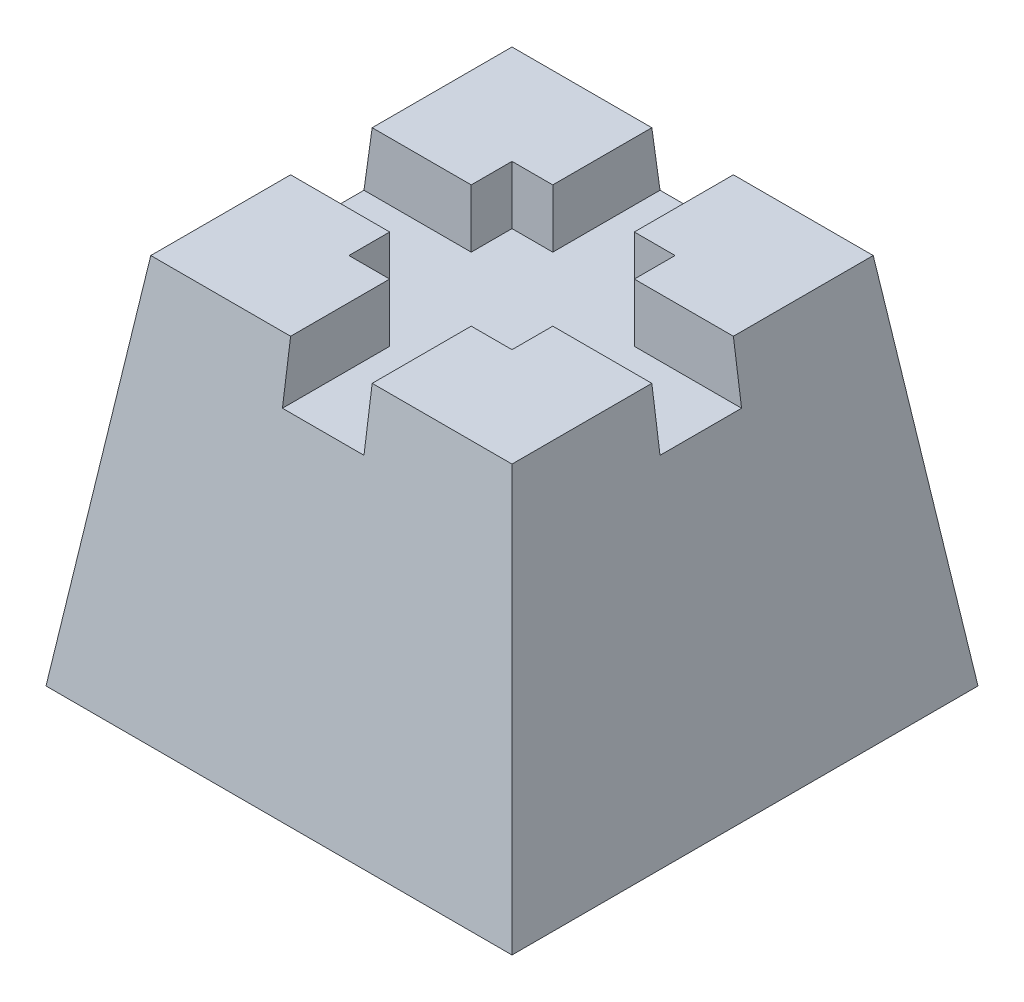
SolidWorks part; units mm, degrees
ref_plane "Front Plane" through (0, 0, 0) normal (0, 0, 1) x (1, 0, 0)
ref_plane "Top Plane" through (0, 0, 0) normal (0, 1, 0) x (1, 0, 0)
ref_plane "Right Plane" through (0, 0, 0) normal (1, 0, 0) x (0, 0, -1)
sketch "Sketch1" plane through (0, 0, 0) normal (0, 1, 0) x (1, 0, 0)
  line L0 (127, 127) -> (-127, -127) construction
  line L1 (-127, 127) -> (127, 127)
  line L2 (-127, 127) -> (-127, -127)
  line L3 (-127, -127) -> (127, -127)
  line L4 (127, 127) -> (127, -127)
  dimension "D1" = 254
extrude "Extrude1" add sketch "Sketch1" along normal blind 203.2 draft 8
sketch "Sketch2" plane through (0, 203.2, 0) normal (0, 1, 0) x (-1, 0, 0)
  line L1 (22.225, -127) -> (-22.225, -127)
  line L2 (22.225, -127) -> (22.225, -22.225)
  line L3 (22.225, 127) -> (-22.225, 127)
  line L4 (-22.225, -127) -> (-22.225, -22.225)
  line L7 (127, 22.225) -> (22.225, 22.225)
  line L8 (127, 22.225) -> (127, -22.225)
  line L9 (127, -22.225) -> (22.225, -22.225)
  line L10 (-127, 22.225) -> (-127, -22.225)
  line L12 (-22.225, -22.225) -> (-127, -22.225)
  line L13 (22.225, 22.225) -> (22.225, 127)
  line L14 (-22.225, 22.225) -> (-127, 22.225)
  line L15 (-22.225, 22.225) -> (-22.225, 127)
  line L16 (0, -127) -> (0, 0) construction
  line L17 (127, 0) -> (0, 0) construction
  line L18 (-127, 127) -> (-127, -127) construction
  line L19 (127, 127) -> (-127, 127) construction
  line L20 (127, -127) -> (127, 127) construction
  line L21 (-127, -127) -> (127, -127) construction
  dimension "D1" = 44.45
extrude "Cut-Extrude1" cut sketch "Sketch2" against normal blind 31.75
sketch "Sketch3" plane through (0, 203.2, 0) normal (0, 1, 0) x (-1, 0, 0)
  line L0 (0, 0) -> (44.45, 0) construction
  line L1 (-44.45, 44.45) -> (44.45, 44.45)
  line L2 (-44.45, 44.45) -> (-44.45, -44.45)
  line L3 (-44.45, -44.45) -> (44.45, -44.45)
  line L4 (44.45, 44.45) -> (44.45, -44.45)
  line L5 (0, 0) -> (0, -44.45) construction
  dimension "D1" = 88.9
extrude "Cut-Extrude2" cut sketch "Sketch3" against normal up to surface (31.75 mm away)
